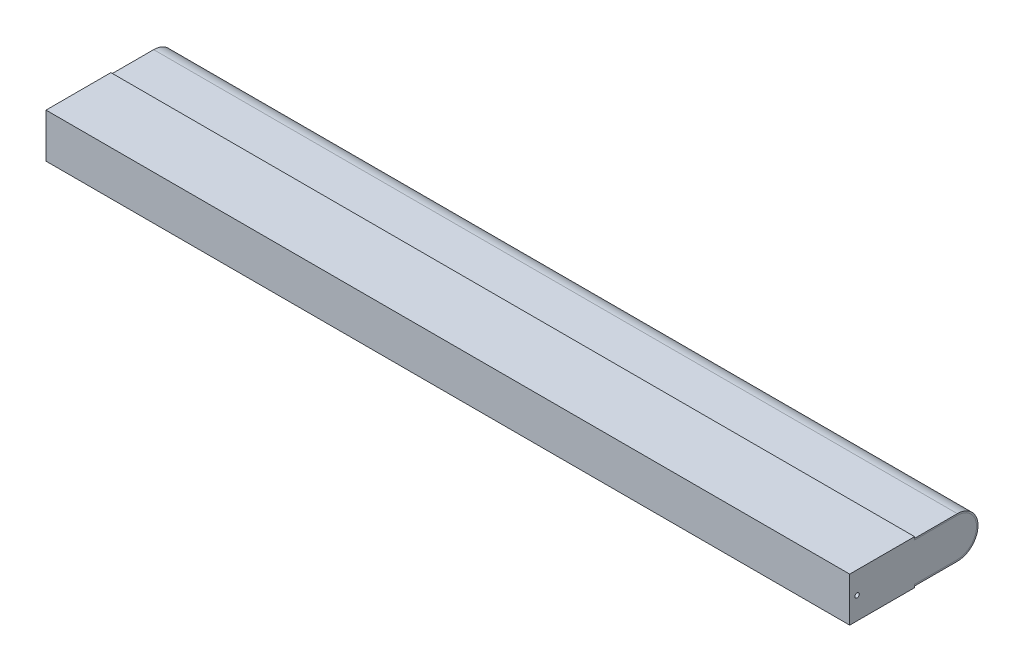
SolidWorks part; units mm, degrees
ref_plane "Alzado" through (0, 0, 0) normal (0, 0, 1) x (1, 0, 0)
ref_plane "Planta" through (0, 0, 0) normal (0, 1, 0) x (1, 0, 0)
ref_plane "Vista lateral" through (0, 0, 0) normal (1, 0, 0) x (0, 0, -1)
sketch "Croquis1" plane through (0, 0, 0) normal (1, 0, 0) x (0, 0, -1)
  line L0 (0, 0) -> (0, 30)
  line L1 (0, 30) -> (44, 30)
  line L2 (44, 30) -> (44, 28)
  line L3 (44, 0) -> (0, 0)
  line L4 (0, 15) -> (86, 15) construction
  line L5 (44, 2) -> (73, 2)
  line L6 (44, 28) -> (73, 28)
  line L7 (0, 28) -> (86, 28) construction
  line L8 (0, 2) -> (86, 2) construction
  line L9 (44, 2) -> (44, 0)
  arc A1 (73, 2) -> (73, 28) centre (73, 15) ccw
  dimension "D1" = 13
  dimension "D3" = 44
  dimension "D5" = 13
  dimension "D4" = 30
  dimension "D6" = 86
  dimension "D2" = 13
extrude "Saliente-Extruir1" add sketch "Croquis1" along normal blind 545
sketch "Croquis2" plane through (0, 0, 0) normal (-1, 0, 0) x (0, 0, 1)
  line L18 (-44, 1) -> (-44, 2)
  line L19 (-44, 29) -> (-44, 28)
  line L20 (-44, 1) -> (-73, 1)
  line L21 (-73, 29) -> (-44, 29)
  line L22 (-44, 1) -> (-73, 1)
  line L23 (-73, 29) -> (-44, 29)
  line L37 (-44, 2) -> (-73, 2)
  line L38 (-73, 28) -> (-44, 28)
  line L39 (-44, 2) -> (-73, 2)
  line L40 (-73, 28) -> (-44, 28)
  arc A5 (-73, 29) -> (-73, 1) centre (-73, 15) ccw
  arc A6 (-73, 29) -> (-73, 1) centre (-73, 15) ccw
  arc A10 (-73, 28) -> (-73, 2) centre (-73, 15) ccw
  arc A11 (-73, 28) -> (-73, 2) centre (-73, 15) ccw
  dimension "D2" = 0
  dimension "D1" = 1
extrude "Saliente-Extruir2" add sketch "Croquis2" against normal blind 545 separate body
ref_plane "Plano1" through (272.5, 0, 0) normal (-1, 0, 0) x (0, 0, 1)
sketch "Croquis5" plane through (0, 0, 0) normal (-1, 0, 0) x (0, 0, 1)
  line L0 (0, 15) -> (-43.6969, 15) construction
  line L1 (0, 30) -> (0, 0) construction
  line L2 (0, 30) -> (-5, 30) construction
  line L3 (-44, 30) -> (0, 30) construction
  line L4 (-5, 30) -> (-5, 0) construction
  line L5 (0, 0) -> (-44, 0) construction
  circle A0 centre (-5, 15) radius 1.5
extrude "Cortar-Extruir1" cut sketch "Croquis5" against normal blind 15
mirror "Simetría1" about plane through (272.5, 0, 0) normal (-1, 0, 0) of "Cortar-Extruir1"
